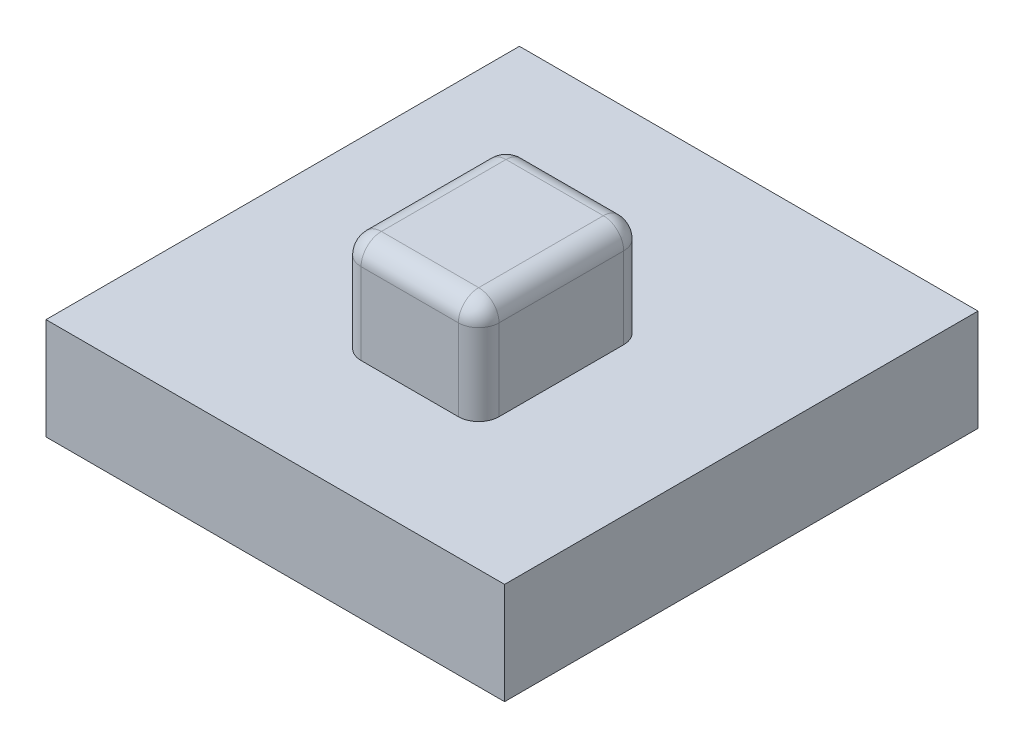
SolidWorks part; units mm, degrees
ref_plane "Front Plane" through (0, 0, 0) normal (0, 0, 1) x (1, 0, 0)
ref_plane "Top Plane" through (0, 0, 0) normal (0, 1, 0) x (1, 0, 0)
ref_plane "Right Plane" through (0, 0, 0) normal (1, 0, 0) x (0, 0, -1)
sketch "Sketch1" plane through (0, 0, 0) normal (0, 1, 0) x (1, 0, 0)
  line L1 (-64.2407, 31.4854) -> (-19.1144, 31.4854)
  line L2 (-64.2407, 31.4854) -> (-64.2407, -15.1001)
  line L3 (-64.2407, -15.1001) -> (-19.1144, -15.1001)
  line L4 (-19.1144, 31.4854) -> (-19.1144, -15.1001)
extrude "Extrude1" add sketch "Sketch1" along normal blind 10
sketch "Sketch2" plane through (0, 10, 0) normal (0, 1, 0) x (1, 0, 0)
  line L1 (-47.2519, 13.1785) -> (-33.6739, 13.1785)
  line L2 (-47.2519, 13.1785) -> (-47.2519, -3.0863)
  line L3 (-47.2519, -3.0863) -> (-33.6739, -3.0863)
  line L4 (-33.6739, 13.1785) -> (-33.6739, -3.0863)
extrude "Extrude2" add sketch "Sketch2" along normal blind 10
fillet "Fillet1" radius 2 8 edges at (-47.2519, 20, -5.0461) (-33.6739, 20, -5.0461) (-40.4629, 20, -13.1785) (-47.2519, 15, -13.1785) (-33.6739, 15, -13.1785) (-33.6739, 15, 3.0863) (-47.2519, 15, 3.0863) (-40.4629, 20, 3.0863)
